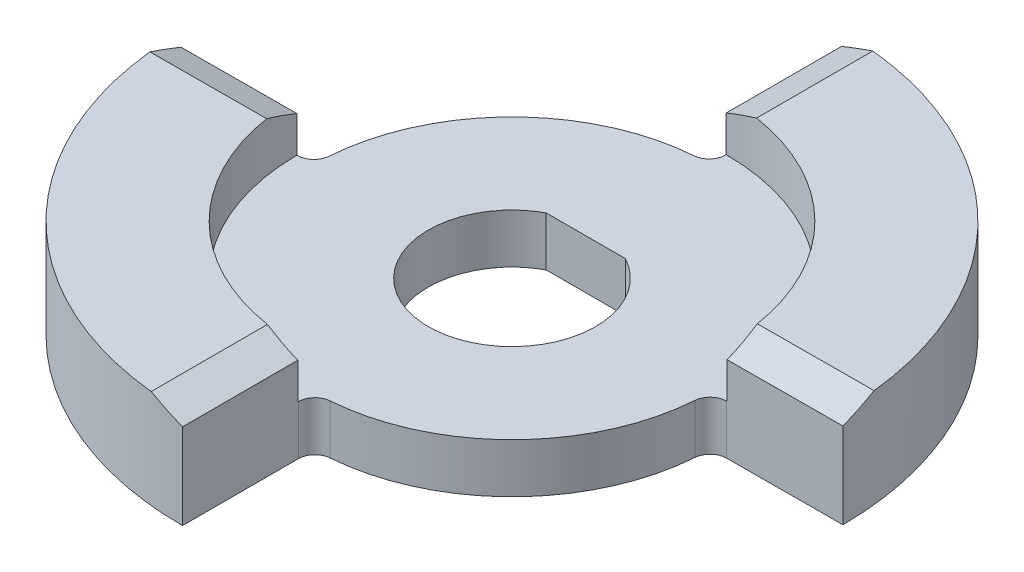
SolidWorks part; units mm, degrees
ref_plane "Front Plane" through (0, 0, 0) normal (0, 0, 1) x (1, 0, 0)
ref_plane "Top Plane" through (0, 0, 0) normal (0, 1, 0) x (1, 0, 0)
ref_plane "Right Plane" through (0, 0, 0) normal (1, 0, 0) x (0, 0, -1)
sketch "Sketch1" plane through (0, 0, 0) normal (0, 1, 0) x (1, 0, 0)
  circle A0 centre (0, 0) radius 31.75
  dimension "D1" = 63.5
extrude "Boss-Extrude1" add sketch "Sketch1" along normal blind 12.7 contours A0
sketch "Sketch3" plane through (0, 12.7, 0) normal (0, 1, 0) x (1, 0, 0)
  line L0 (-3.81, 7.1077) -> (3.81, 7.1077)
  arc A0 (-3.81, 7.1077) -> (3.81, 7.1077) centre (0, 0) ccw
  dimension "D2" = 16.129
  dimension "D1" = 7.62
sketch "Sketch2" plane through (0, 12.7, 0) normal (0, 1, 0) x (1, 0, 0)
  line L0 (0, -19.05) -> (0, -31.75)
  line L1 (0, 0) -> (19.0498, 0.0831) construction
  line L2 (19.0498, 0.0831) -> (31.7497, 0.1385)
  arc A0 (0, -19.05) -> (19.0498, 0.0831) centre (0, 0) ccw
  arc A3 (0, -31.75) -> (31.7497, 0.1385) centre (0, 0) ccw
  circle A4 centre (0, 0) radius 31.75 construction
  dimension "D2" = 19.05
  dimension "D1" = 90.25
extrude "Cut-Extrude1" cut sketch "Sketch2" against normal through all contours L2 A3 L0 A0
sketch "Sketch4" plane through (0, 12.7, 0) normal (0, 1, 0) x (1, 0, 0)
  circle A0 centre (0, 0) radius 19.05
  dimension "D1" = 38.1
extrude "Cut-Extrude3" cut sketch "Sketch4" against normal blind 6.35
chamfer "Chamfer1" distance 3.175 angle 22 1 edges at (0, 12.7, 25.4)
chamfer "Chamfer2" distance 3.175 angle 22 1 edges at (25.3998, 12.7, -0.1108)
pattern_circular "CirPattern1" count 2 over 360 about axis through (0, 0, 0) along (0, 1, 0) of "Cut-Extrude1", "Chamfer1", "Chamfer2"
extrude "Cut-Extrude4" cut sketch "Sketch3" against normal through all
sketch "Sketch6" plane through (0, 6.35, 0) normal (0, 1, 0) x (1, 0, 0)
  line L1 (3.81, 7.1077) -> (-3.81, 7.1077)
  circle A0 centre (0, 0) radius 19.05
  arc A2 (-3.81, 7.1077) -> (3.81, 7.1077) centre (0, 0) ccw
extrude "Boss-Extrude2" add sketch "Sketch6" along normal blind 3.175
sketch "Sketch7" plane through (0, 0, 0) normal (0, -1, 0) x (1, 0, 0)
  circle A0 centre (0, 0) radius 52.0779
extrude "Cut-Extrude5" cut sketch "Sketch7" against normal blind 3.175
sketch "Sketch8" plane through (0, 9.525, 0) normal (0, 1, 0) x (1, 0, 0)
  circle A0 centre (0, 0) radius 20.6375
  arc A1 (0, -19.05) -> (19.0498, 0.0831) centre (0, 0) ccw construction
  dimension "D1" = 1.5875
extrude "Cut-Extrude6" cut sketch "Sketch8" along normal up to surface (3.175 mm away) contours A0
fillet "Fillet8" radius 1.5875 4 edges at (-19.0498, 6.35, 0.0831) (0, 6.35, -19.05) (0, 6.35, 19.05) (19.0498, 6.35, -0.0831)
sketch "Sketch9" plane through (0, 9.525, 0) normal (0, 1, 0) x (1, 0, 0)
  circle A0 centre (0, 0) radius 20.6375
extrude "Cut-Extrude7" cut sketch "Sketch9" against normal blind 1.5875
